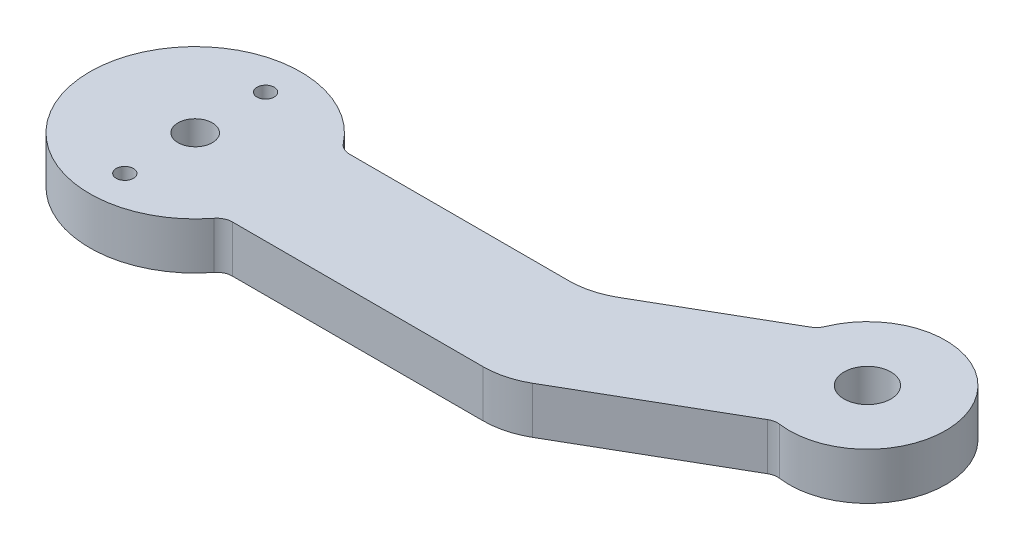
SolidWorks part; units mm, degrees
ref_plane "Face" through (0, 0, 0) normal (0, 0, 1) x (1, 0, 0)
ref_plane "Dessus" through (0, 0, 0) normal (0, 1, 0) x (1, 0, 0)
ref_plane "Droite" through (0, 0, 0) normal (1, 0, 0) x (0, 0, -1)
sketch "Esquisse1" plane through (0, 0, 0) normal (0, 1, 0) x (1, 0, 0)
  line L0 (87.6177, 0) -> (-18.6202, 0) construction
  line L1 (0, -18.98) -> (0, 28.1312) construction
  line L2 (45, 28.1312) -> (45, -7.5) construction
  line L3 (45, 0) -> (102.4097, 33.1455) construction
  line L4 (89.5289, -7.5) -> (-18.8852, -7.5) construction
  line L6 (89.5289, 7.5) -> (-18.8852, 7.5) construction
  line L7 (38.7951, -12.2427) -> (107.3009, 27.3092) construction
  line L8 (32.5228, 1.4565) -> (97.461, 38.9486) construction
  line L9 (45, 0) -> (28.5006, 28.5777) construction
  line L10 (12.2474, -7.5) -> (44.3301, -7.5)
  line L11 (57.871, 37.7067) -> (81.7631, -3.6755) construction
  line L12 (12.2474, 7.5) -> (40.3109, 7.5)
  line L13 (45.3109, 8.8397) -> (60.8815, 17.8295)
  line L14 (49.3301, -6.1603) -> (68.3815, 4.8391)
  circle A0 centre (0, 0) radius 2.2
  arc A1 (10.6671, 8.2742) -> (10.6671, -8.2742) centre (0, 0) ccw
  arc A3 (69.6481, 5.0892) -> (61.7314, 18.8013) centre (70.9808, 15) ccw
  circle A4 centre (0, 0) radius 9 construction
  circle A8 centre (0, 9) radius 1.1
  circle A16 centre (0, -9) radius 1.1
  circle A21 centre (70.9808, 15) radius 3
  arc A22 (45.3109, 8.8397) -> (40.3109, 7.5) centre (40.3109, 17.5) cw
  arc A23 (49.3301, -6.1603) -> (44.3301, -7.5) centre (44.3301, 2.5) cw
  arc A24 (12.2474, -7.5) -> (10.6671, -8.2742) centre (12.2474, -9.5) ccw
  arc A25 (12.2474, 7.5) -> (10.6671, 8.2742) centre (12.2474, 9.5) cw
  arc A26 (60.8815, 17.8295) -> (61.7314, 18.8013) centre (59.8815, 19.5615) ccw
  arc A27 (68.3815, 4.8391) -> (69.6481, 5.0892) centre (69.3815, 3.107) cw
  circle A28 centre (3.4442, -8.3149) radius 1.1
  circle A29 centre (6.364, -6.364) radius 1.1
  circle A30 centre (8.3149, -3.4442) radius 1.1
  circle A31 centre (9, 0) radius 1.1
  circle A32 centre (8.3149, 3.4442) radius 1.1
  circle A33 centre (6.364, 6.364) radius 1.1
  circle A34 centre (3.4442, 8.3149) radius 1.1
  circle A35 centre (-3.4442, 8.3149) radius 1.1
  circle A36 centre (-6.364, 6.364) radius 1.1
  circle A37 centre (-8.3149, 3.4442) radius 1.1
  circle A38 centre (-9, 0) radius 1.1
  circle A39 centre (-8.3149, -3.4442) radius 1.1
  circle A40 centre (-6.364, -6.364) radius 1.1
  circle A41 centre (-3.4442, -8.3149) radius 1.1
  point P74 (11.225, -7.5)
  point P77 (11.225, 7.5)
  point P80 (61.5025, 18.188)
  point P83 (69.0025, 5.1976)
  dimension "D1" = 45
  dimension "D3" = 30
  dimension "D10" = 10
  dimension "D11" = 2
  dimension "D4" = 7.5
  dimension "D5" = 15
  dimension "D6" = 7.5
  dimension "D7" = 15
  dimension "D8" = 90
  dimension "D9" = 30
extrude "Extrusion1" add sketch "Esquisse1" along normal blind 6
